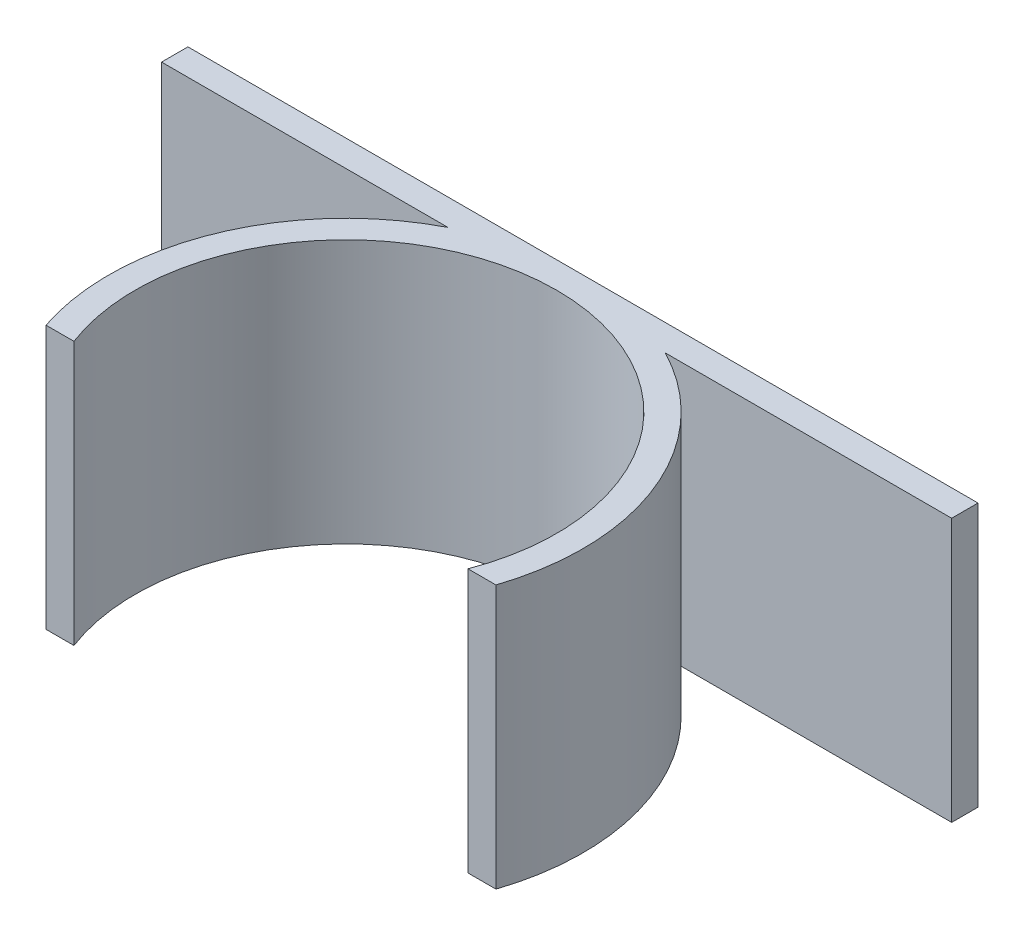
SolidWorks part; units mm, degrees
ref_plane "前视基准面" through (0, 0, 0) normal (0, 0, 1) x (1, 0, 0)
ref_plane "上视基准面" through (0, 0, 0) normal (0, 1, 0) x (1, 0, 0)
ref_plane "右视基准面" through (0, 0, 0) normal (1, 0, 0) x (0, 0, -1)
other "Configuration Table"
sketch "草图1" plane through (0, 0, 0) normal (0, 1, 0) x (1, 0, 0)
  circle A0 centre (0, 0) radius 8
  circle A1 centre (0, 0) radius 9
extrude "凸台-拉伸1" add sketch "草图1" along normal blind 10
sketch "草图2" plane through (0, 0, 0) normal (0, -1, 0) x (1, 0, 0)
  line L0 (0, -8) -> (0, -9)
  line L2 (-14.9949, -9) -> (14.9949, -9)
  line L3 (-14.9949, -9) -> (-14.9949, -8)
  line L4 (-14.9949, -8) -> (14.9949, -8)
  line L5 (14.9949, -9) -> (14.9949, -8)
  line L6 (-14.9949, -9) -> (14.9949, -8) construction
  line L7 (-14.9949, -8) -> (14.9949, -9) construction
  circle A0 centre (0, 0) radius 8 construction
  circle A1 centre (0, 0) radius 9 construction
  point P8 (0, -8.5)
extrude "凸台-拉伸2" add sketch "草图2" against normal blind 10 contours L2 L5 L4 M2 | L4 L3 L2 M2
sketch "草图3" plane through (0, 0, 0) normal (0, -1, 0) x (1, 0, 0)
  line L1 (9, 9) -> (-9, 9)
  line L2 (9, 9) -> (9, 3.3936)
  line L3 (9, 3.3936) -> (-9, 3.3936)
  line L4 (-9, 9) -> (-9, 3.3936)
extrude "切除-拉伸2" cut sketch "草图3" against normal blind 10
sketch "草图5" plane through (0, 0, 0) normal (0, -1, 0) x (1, 0, 0)
  line L1 (-8.7816, 3.5498) -> (9.1354, 3.5498)
  line L2 (-8.7816, 3.5498) -> (-8.7816, 2.8421)
  line L3 (-8.7816, 2.8421) -> (9.1354, 2.8421)
  line L4 (9.1354, 3.5498) -> (9.1354, 2.8421)
extrude "切除-拉伸3" cut sketch "草图5" against normal blind 10
